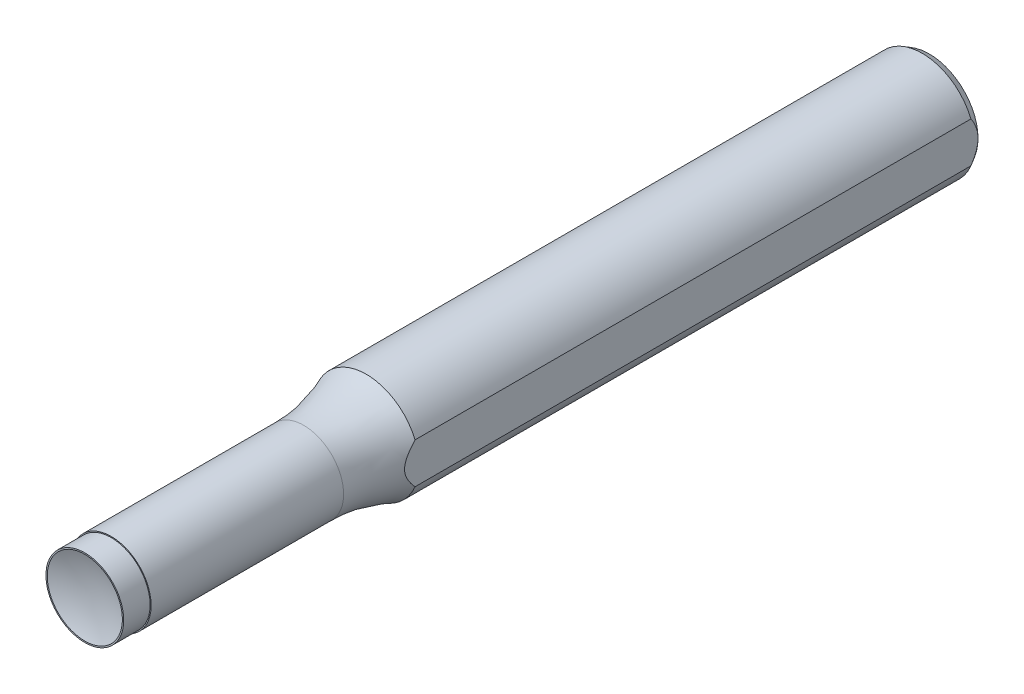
SolidWorks part; units mm, degrees
ref_plane "Front Plane" through (0, 0, 0) normal (0, 0, 1) x (1, 0, 0)
ref_plane "Top Plane" through (0, 0, 0) normal (0, 1, 0) x (1, 0, 0)
ref_plane "Right Plane" through (0, 0, 0) normal (1, 0, 0) x (0, 0, -1)
sketch "Sketch1" plane through (0, 0, 0) normal (0, 0, 1) x (1, 0, 0)
  circle A0 centre (0, 0) radius 7.94
  dimension "D1" = 15.88
extrude "Boss-Extrude1" add sketch "Sketch1" against normal blind 127
sketch "Sketch2" plane through (0, 0, 0) normal (0, 0, 1) x (1, 0, 0)
  circle A0 centre (0, 0) radius 6
  dimension "D1" = 12
extrude "Cut-Extrude1" cut sketch "Sketch2" against normal blind 42.3333 flip side to cut
sketch "Sketch3" plane through (0, 0, 0) normal (0, 0, 1) x (1, 0, 0)
  circle A0 centre (0, 0) radius 5.85
  dimension "D1" = 11.7
extrude "Cut-Extrude2" cut sketch "Sketch3" against normal blind 3.97 flip side to cut
sketch "Sketch4" plane through (0, 0, 0) normal (1, 0, 0) x (0, 0, -1)
  line L0 (0, 0) -> (0, 5.65)
  line L1 (0, 5.85) -> (0, -5.85) construction
  line L2 (1.0391, 0) -> (1.0391, 5.65) construction
  line L3 (0, 0) -> (1.0391, 0)
  line L4 (0, 0) -> (0, -5.65) construction
  arc A0 (1.0391, 0) -> (0, 5.65) centre (-14.8409, 0) ccw
  dimension "D2" = 15.88
  dimension "D1" = 11.3
revolve "Cut-Revolve1" cut sketch "Sketch4" angle 360 about L3
chamfer "Chamfer1" distance 1.0587 angle 30 1 edges at (7.94, 0, -127)
sketch "Sketch5" plane through (0, 0, 0) normal (1, 0, 0) x (0, 0, -1)
  line L0 (42.3333, 0) -> (32.9175, 0)
  line L1 (42.3333, 7.94) -> (42.3333, -7.94) construction
  line L2 (32.9175, 0) -> (32.9175, 6)
  line L3 (42.3333, 6) -> (3.97, 6) construction
  line L4 (42.3333, 7.94) -> (42.3333, 0)
  line L5 (32.9175, 6) -> (42.3333, 6) construction
  arc A0 (32.9175, 6) -> (42.3333, 7.94) centre (32.9175, 29.82) ccw
  dimension "D1" = 23.82
revolve "Revolve1" add sketch "Sketch5" angle 360 about L0
sketch "Sketch6" plane through (0, 0, 0) normal (1, 0, 0) x (0, 0, -1)
  line L0 (84.6667, 0) -> (108.4867, 0)
  line L1 (84.6667, 0) -> (84.6667, 15.88)
  line L2 (84.6667, 15.88) -> (94.7342, 15.88)
  line L3 (108.4867, 0) -> (108.4867, 7.94)
  line L4 (125.9413, 7.94) -> (42.3333, 7.94) construction
  line L5 (108.4867, 7.94) -> (84.6667, 7.94) construction
  line L6 (127, -7.94) -> (127, 7.94) construction
  arc A0 (108.4867, 7.94) -> (94.7342, 15.88) centre (108.4867, 23.82) cw
  dimension "D2" = 15.88
  dimension "D1" = 42.3333
  dimension "D3" = 23.82
revolve "Revolve2" [suppressed] add sketch "Sketch6" angle 360 about L0
sketch "Sketch7" plane through (0, 0, -127) normal (0, 0, -1) x (-1, 0, 0)
  line L9 (-13.4386, 3.0549) -> (-7.3288, 3.0549)
  line L10 (-13.4386, 3.0549) -> (-13.4386, -3.0549)
  line L11 (-13.4386, -3.0549) -> (-7.3288, -3.0549)
  line L12 (-7.3288, 3.0549) -> (-7.3288, -3.0549)
  circle A5 centre (0, 0) radius 7.94 construction
  circle A6 centre (0, 0) radius 7.3288 construction
  point P8 (-7.3288, 0)
extrude "Cut-Extrude3" cut sketch "Sketch7" against normal through all
